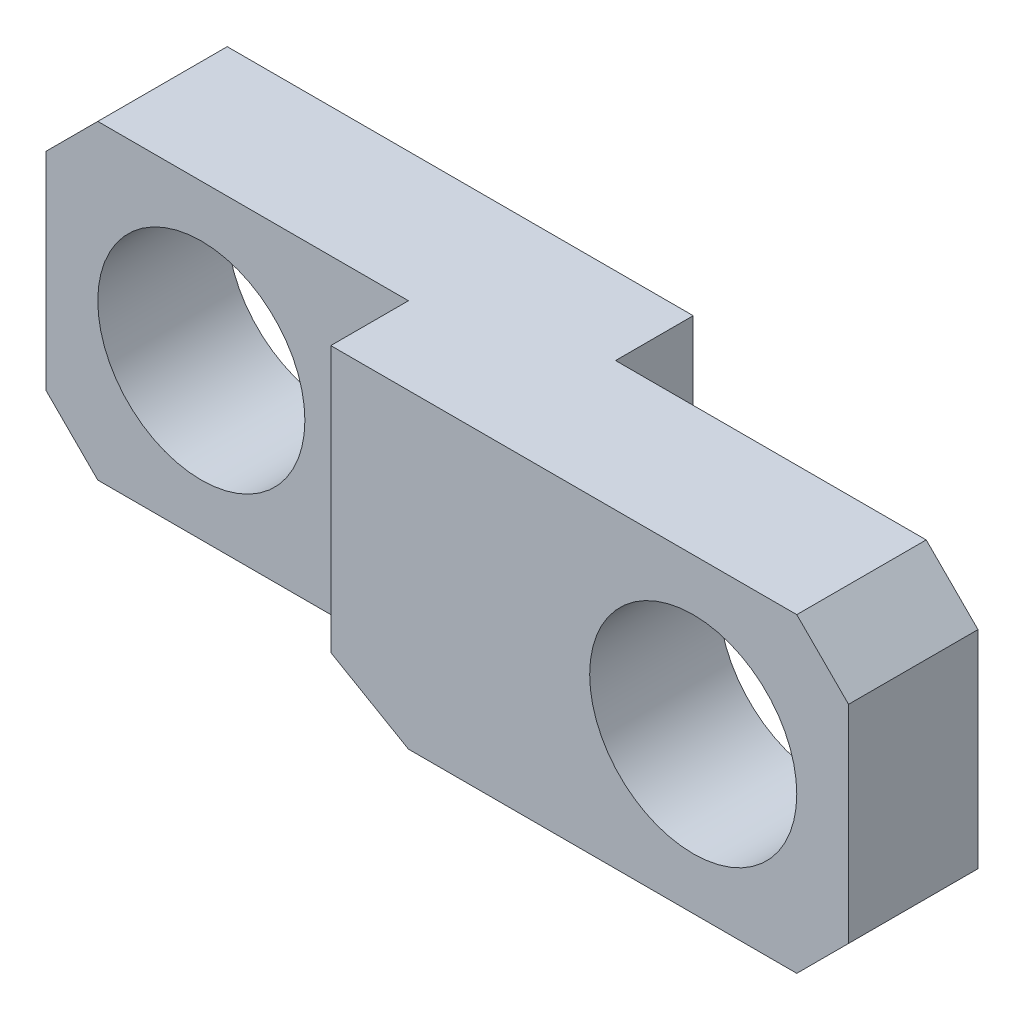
SolidWorks part; units mm, degrees
ref_plane "Plan1" through (0, 0, 0) normal (0, 0, 1) x (1, 0, 0)
ref_plane "Plan2" through (0, 0, 0) normal (0, 1, 0) x (1, 0, 0)
ref_plane "Plan3" through (0, 0, 0) normal (1, 0, 0) x (0, 0, -1)
sketch "Esquisse1" plane through (0, 0, 0) normal (0, 0, 1) x (1, 0, 0)
  line L0 (-30, 30) -> (4, 30)
  line L1 (-30, 30) -> (-30, 18)
  line L2 (4, 18) -> (-30, 18)
  line L3 (4, 18) -> (4, 30)
  circle A0 centre (-24, 24) radius 4
  circle A1 centre (-2, 24) radius 4
  dimension "D3" = 8
  dimension "D1" = 12
  dimension "D2" = 34
  dimension "D4" = 6
  dimension "D5" = 6
  dimension "D6" = 22
extrude "Base-Extrusion" add sketch "Esquisse1" along normal blind 8
chamfer "Chanfrein1" distance 2 angle 45
chamfer "Chanfrein2" distance 2 angle 45
sketch "Esquisse2" plane through (0, 0, 8) normal (0, 0, 1) x (1, 0, 0)
  line L0 (-30, 30) -> (-16, 30)
  line L2 (-30, 30) -> (-30, 18)
  line L4 (-16, 18) -> (-30, 18)
  line L5 (-16, 18) -> (-16, 30)
  line L6 (2, 18) -> (-28, 18) construction
  dimension "D1" = 14
extrude "Enlèv. mat.-Extru.1" cut sketch "Esquisse2" against normal blind 3
sketch "Esquisse3" plane through (0, 0, 0) normal (0, 0, -1) x (-1, 0, 0)
  line L0 (-4, 18) -> (10, 18)
  line L1 (-4, 18) -> (-4, 30)
  line L2 (10, 30) -> (-4, 30)
  line L3 (10, 30) -> (10, 18)
  dimension "D1" = 14
extrude "Enlèv. mat.-Extru.2" cut sketch "Esquisse3" against normal blind 3
chamfer "Chanfrein3" distance 3 angle 30
